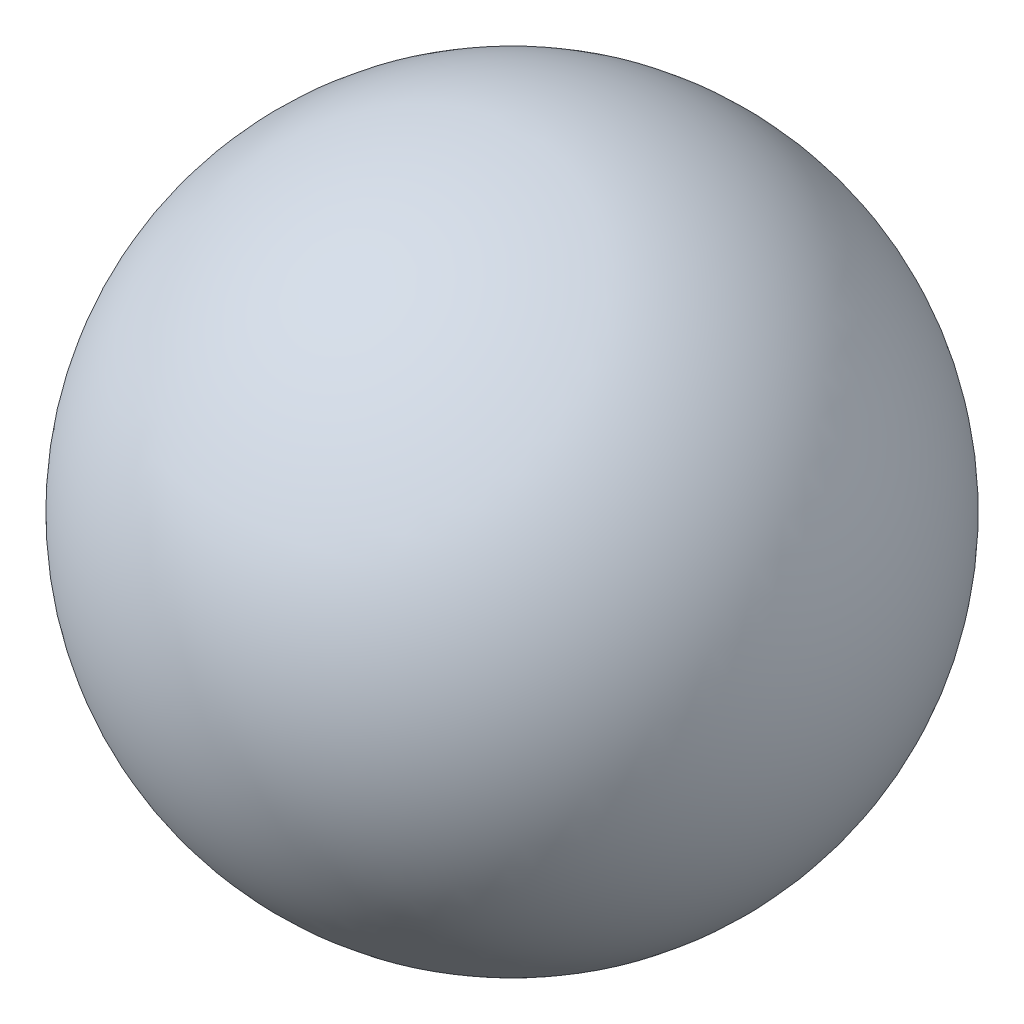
SolidWorks part; units mm, degrees
ref_plane "X_Y" through (0, 0, 0) normal (0, 0, 1) x (1, 0, 0)
ref_plane "Z_X" through (0, 0, 0) normal (0, 1, 0) x (1, 0, 0)
ref_plane "Y_Z" through (0, 0, 0) normal (1, 0, 0) x (0, 0, -1)
sketch "Sketch1" plane through (0, 0, 0) normal (0, 0, 1) x (1, 0, 0)
  line L0 (0, 1.1906) -> (0, -1.1906)
  arc A0 (0, 1.1906) -> (0, -1.1906) centre (0, 0) cw
  dimension "D1" = 1.1906
revolve "Revolve1" add sketch "Sketch1" angle 360 about L0
